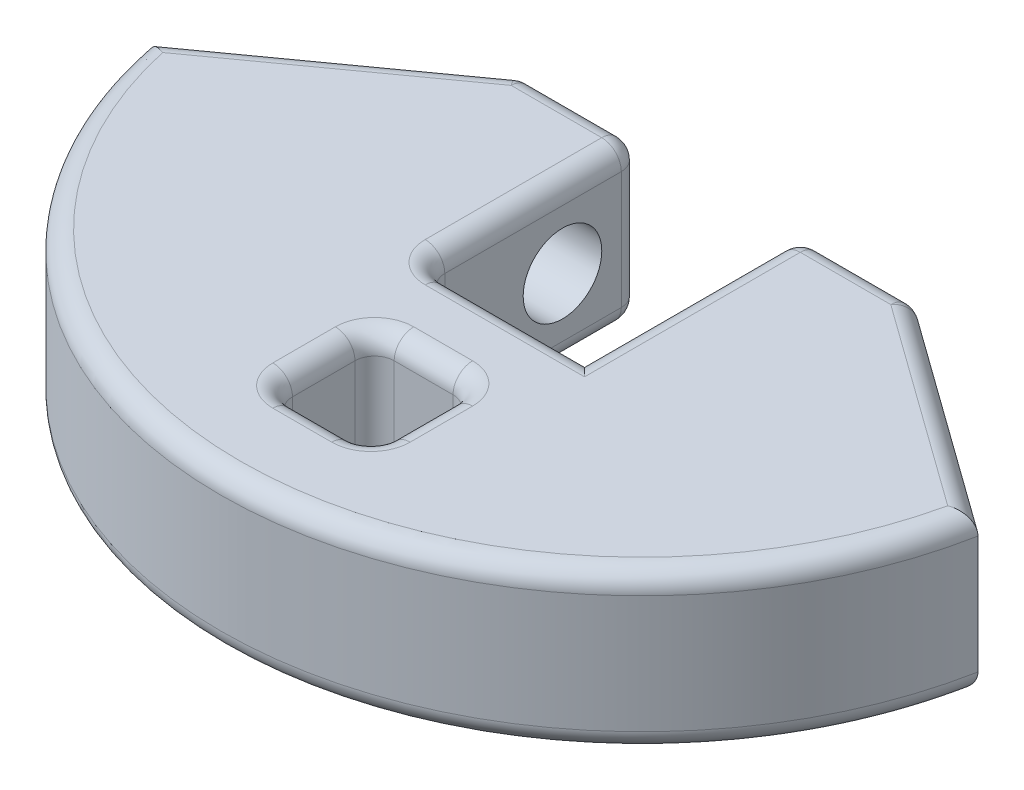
SolidWorks part; units mm, degrees
ref_plane "Front Plane" through (0, 0, 0) normal (0, 0, 1) x (1, 0, 0)
ref_plane "Top Plane" through (0, 0, 0) normal (0, 1, 0) x (1, 0, 0)
ref_plane "Right Plane" through (0, 0, 0) normal (1, 0, 0) x (0, 0, -1)
sketch "Sketch1" plane through (0, 0, 0) normal (0, 1, 0) x (1, 0, 0)
  line L5 (-33.5354, 6.35) -> (-6.4492, 6.35)
  line L6 (-6.4492, 6.35) -> (-6.4492, -11.1125)
  line L7 (-6.4492, -11.1125) -> (6.4492, -11.1125)
  line L8 (6.4492, -11.1125) -> (6.4492, 6.35)
  line L9 (6.4492, 6.35) -> (33.5354, 6.35)
  line L10 (-4.8571, 0) -> (5.7505, 0) construction
  line L11 (-4.8571, 3.175) -> (4.8571, 3.175) construction
  line L12 (-4.8571, 3.175) -> (-4.8571, -3.175) construction
  line L13 (-4.8571, -3.175) -> (4.8571, -3.175) construction
  line L14 (4.8571, 3.175) -> (4.8571, -3.175) construction
  arc A8 (-33.5354, 6.35) -> (33.5354, 6.35) centre (0, 0) ccw
  point P10 (0, -11.1125)
  point P16 (0, 3.175)
  point P17 (0, 0)
  dimension "D1" = 34.1313
  dimension "D3" = 12.8984
  dimension "D2" = 11.1125
  dimension "D4" = 6.35
  dimension "D5" = 3.175
extrude "Boss-Extrude1" add sketch "Sketch1" along normal mid plane 12.7
sketch "Sketch2" plane through (0, 0, 0) normal (0, 1, 0) x (1, 0, 0)
  line L0 (-39.3388, -6.35) -> (-33.5354, -6.35)
  line L1 (-15.875, 6.35) -> (-15.875, 13.8998)
  line L2 (-15.875, 13.8998) -> (15.875, 13.8998)
  line L3 (15.875, 13.8998) -> (15.875, 6.35)
  line L4 (33.5354, -6.35) -> (44.2479, -6.35)
  line L5 (44.2479, -6.35) -> (44.2479, 26.2331)
  line L6 (44.2479, 26.2331) -> (-39.3388, 26.2331)
  line L7 (-39.3388, 26.2331) -> (-39.3388, -6.35)
  line L8 (-4.8571, -3.175) -> (4.8571, -3.175) construction
  line L9 (-15.875, 6.35) -> (-33.5354, -6.35)
  line L10 (15.875, 6.35) -> (33.5354, -6.35)
  line L11 (-6.4492, 6.35) -> (-33.5354, 6.35) construction
  line L12 (33.5354, 6.35) -> (6.4492, 6.35) construction
  arc A0 (-33.5354, 6.35) -> (33.5354, 6.35) centre (0, 0) ccw construction
  point P2 (0, 13.8998)
  point P5 (0, 0)
  point P18 (0, 0)
  point P21 (0, 0)
  dimension "D1" = 31.75
  dimension "D2" = 3.175
extrude "Cut-Extrude1" cut sketch "Sketch2" against normal through all both and the other way through all
sketch "Sketch3" plane through (0, 0, 0) normal (1, 0, 0) x (0, 0, -1)
  circle A0 centre (0, 0) radius 3.1813
  dimension "D1" = 6.3627
extrude "Cut-Extrude2" cut sketch "Sketch3" against normal through all both and the other way through all
fillet "Fillet1" radius 1.5875 21 edges at (-6.4492, 0, -6.35) (6.4492, 0, -6.35) (11.1621, -6.35, -6.35) (6.4492, -6.35, 2.3812) (0, -6.35, 11.1125) (-6.4492, -6.35, 2.3812) (-11.1621, -6.35, -6.35) (0, -6.35, 34.1313) (0, 6.35, 34.1313) (-11.1621, 6.35, -6.35) (-6.4492, 6.35, 2.3812) (0, 6.35, 11.1125) (6.4492, 6.35, 2.3812) (11.1621, 6.35, -6.35) (-6.4492, 0, 11.1125) (-15.875, 0, -6.35) (15.875, 0, -6.35) (-24.7052, -6.35, 0) (24.7052, -6.35, 0) (-24.7052, 6.35, 0) (24.7052, 6.35, 0)
sketch "Sketch4" plane through (0, 0, 0) normal (1, 0, 0) x (0, 0, -1)
  line L0 (-32.5438, -6.35) -> (-7.0384, -6.35) construction
  line L1 (-25.4, 6.35) -> (-19.05, 6.35) construction
  line L2 (-25.4, 6.35) -> (-25.4, -10.0841) construction
  line L3 (-25.4, -10.0841) -> (-19.05, -10.0841) construction
  line L4 (-19.05, 6.35) -> (-19.05, -10.0841) construction
  line L5 (-26.3409, 7.0031) -> (-25.9233, 6.35)
  line L6 (-7.0384, 6.35) -> (-32.5438, 6.35) construction
  line L7 (-17.6909, -6.35) -> (-16.5237, -7.0955)
  circle A0 centre (0, 0) radius 19.05 construction
  circle A1 centre (0, 0) radius 26.1817 construction
  circle A2 centre (0, 0) radius 18.796
  circle A3 centre (0, 0) radius 26.6897
  point P20 (0, 0)
  point P21 (-25.9233, 6.35)
  point P22 (-17.6909, -6.35)
  point P23 (0, 0)
  dimension "D1" = 6.35
  dimension "D2" = 19.05
  dimension "D5" = 12.7
  dimension "D3" = 0.254
  dimension "D4" = 0.508
sketch "Sketch5" plane through (0, 0, 0) normal (1, 0, 0) x (0, 0, -1)
  line L6 (-25.9233, 6.35) -> (-17.6909, 6.35)
  line L7 (-25.9233, 6.35) -> (-25.9233, -6.35)
  line L8 (-25.9233, -6.35) -> (-17.6909, -6.35)
  line L9 (-17.6909, 6.35) -> (-17.6909, -6.35)
extrude "Cut-Extrude3" cut sketch "Sketch5" against normal mid plane 7.9375
fillet "Fillet2" radius 1.5875 12 edges at (-3.9688, 6.35, 21.8071) (3.9688, 6.35, 21.8071) (-3.9688, -6.35, 21.8071) (3.9688, -6.35, 21.8071) (0, -6.35, 17.6909) (-3.9688, 0, 17.6909) (0, 6.35, 17.6909) (3.9688, 0, 17.6909) (0, 6.35, 25.9233) (-3.9688, 0, 25.9233) (0, -6.35, 25.9233) (3.9688, 0, 25.9233)
